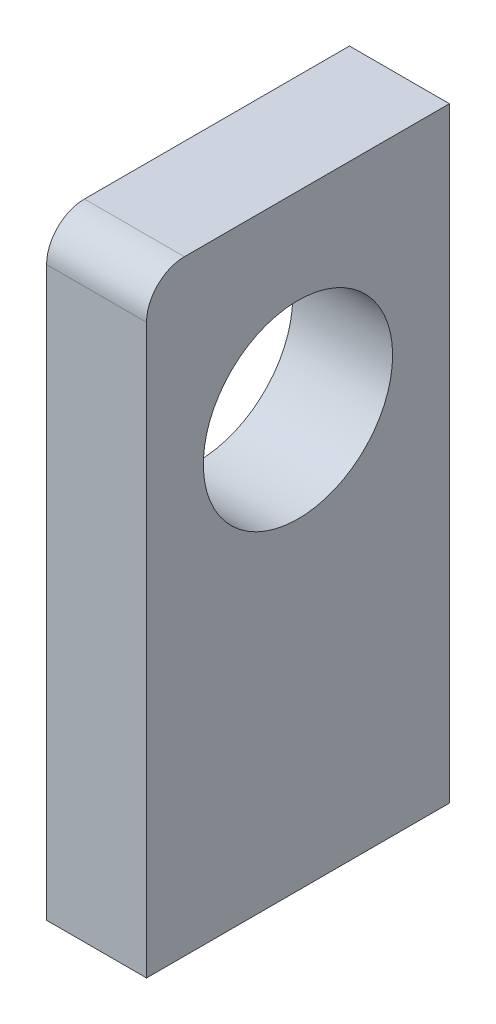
SolidWorks part; units mm, degrees
ref_plane "Front Plane" through (0, 0, 0) normal (0, 0, 1) x (1, 0, 0)
ref_plane "Top Plane" through (0, 0, 0) normal (0, 1, 0) x (1, 0, 0)
ref_plane "Right Plane" through (0, 0, 0) normal (1, 0, 0) x (0, 0, -1)
sketch "Sketch1" plane through (0, 0, 0) normal (1, 0, 0) x (0, 0, -1)
  line L1 (0, 0) -> (40, 0)
  line L2 (0, 0) -> (0, -80)
  line L3 (0, -80) -> (40, -80)
  line L4 (40, 0) -> (40, -80)
  circle A0 centre (20, -25) radius 12.5
  point P7 (20, 0)
  dimension "D2" = 25
  dimension "D1" = 80
  dimension "D3" = 40
  dimension "D4" = 25
extrude "Boss-Extrude1" add sketch "Sketch1" along normal blind 13.2
fillet "Fillet2" radius 5 1 edges at (6.6, 0, 0)
